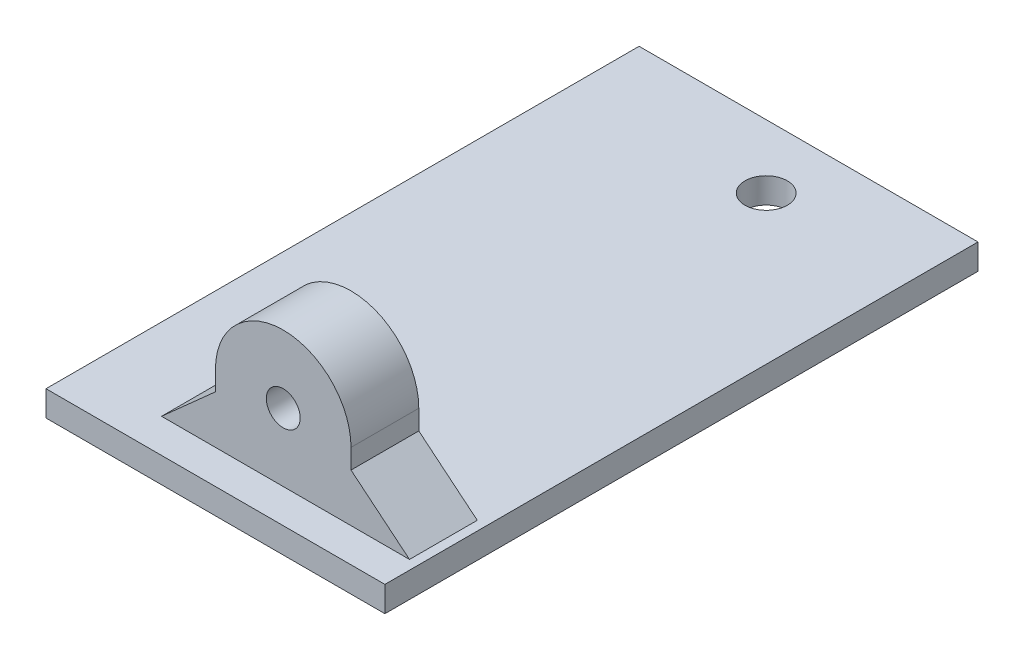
SolidWorks part; units mm, degrees
ref_plane "Front Plane" through (0, 0, 0) normal (0, 0, 1) x (1, 0, 0)
ref_plane "Top Plane" through (0, 0, 0) normal (0, 1, 0) x (1, 0, 0)
ref_plane "Right Plane" through (0, 0, 0) normal (1, 0, 0) x (0, 0, -1)
sketch "Sketch1" plane through (0, 0, 0) normal (0, 1, 0) x (1, 0, 0)
  line L1 (-40, -30) -> (40, -30)
  line L2 (-40, -30) -> (-40, 30)
  line L3 (-40, 30) -> (40, 30)
  line L4 (40, -30) -> (40, 30)
  line L5 (0, 30) -> (0, -30) construction
  line L6 (-40, 0) -> (40, 0) construction
  point P0 (0, 0)
  dimension "D1" = 60
  dimension "D2" = 80
extrude "Boss-Extrude1" add sketch "Sketch1" along normal blind 3
sketch "Sketch3" plane through (0, 3, 0) normal (0, 1, 0) x (1, 0, 0)
  line L1 (-26.5, -22.5) -> (22.5, -22.5)
  line L2 (-26.5, -22.5) -> (-26.5, 22.5)
  line L3 (-26.5, 22.5) -> (22.5, 22.5)
  line L4 (22.5, -22.5) -> (22.5, 22.5)
  line L5 (-2, 22.5) -> (-2, -22.5) construction
  line L6 (-26.5, 0) -> (22.5, 0) construction
  circle A0 centre (-26.5, 22.5) radius 2.5
  circle A1 centre (22.5, 22.5) radius 2.5
  circle A2 centre (22.5, -22.5) radius 2.5
  circle A3 centre (-26.5, -22.5) radius 2.5
  point P9 (-2, 0)
  dimension "D1" = 5
  dimension "D2" = 49
  dimension "D3" = 45
  dimension "D4" = 22.5
extrude "Cut-Extrude1" cut sketch "Sketch3" against normal blind 10 contours L3 A0 L2 | L2 A0 L3 | L4 A1 L3 | L3 A1 L4 | L1 A2 L4 | L4 A2 L1 | L2 A3 L1 | L1 A3 L2
sketch "Sketch9" plane through (0, 3, 0) normal (0, 1, 0) x (1, 0, 0)
  line L1 (-33, 8.2578) -> (-17, 8.2578)
  line L2 (-33, 8.2578) -> (-33, 0.2578)
  line L3 (-33, 0.2578) -> (-17, 0.2578)
  line L4 (-17, 8.2578) -> (-17, 0.2578)
  line L5 (-25, 0.2578) -> (-25, 8.2578) construction
  line L6 (-33, 4.2578) -> (-17, 4.2578) construction
  point P0 (-25, 4.2578)
  dimension "D1" = 8
  dimension "D2" = 16
  dimension "D4" = 25
extrude "Boss-Extrude3" add sketch "Sketch9" along normal blind 50
sketch "Sketch10" plane through (0, 0, -0.2578) normal (0, 0, 1) x (1, 0, 0)
  line L0 (-33, 53) -> (-17, 53) construction
  line L1 (-33, 53) -> (-33, 3) construction
  line L2 (-17, 53) -> (-17, 3) construction
  line L3 (-33, 45) -> (-33, 53)
  line L4 (-33, 53) -> (-17, 53)
  line L5 (-17, 53) -> (-17, 45)
  circle A0 centre (-25, 45) radius 8
extrude "Cut-Extrude3" cut sketch "Sketch10" against normal blind 50
sketch "Sketch11" plane through (0, 3, 0) normal (0, 1, 0) x (1, 0, 0)
  line L0 (24, -36) -> (24, -31.3272) construction
  line L1 (16, -28) -> (32, -28)
  line L2 (16, -28) -> (16, -36)
  line L3 (16, -36) -> (32, -36)
  line L4 (32, -28) -> (32, -36)
  line L5 (24, -36) -> (24, -28) construction
  line L6 (16, -32) -> (32, -32) construction
  point P0 (24, -32)
  dimension "D1" = 8
  dimension "D2" = 16
  dimension "D3" = 32
  dimension "D4" = 16
extrude "Boss-Extrude4" add sketch "Sketch11" along normal blind 16 contours L1 L4 L3 L2
sketch "Sketch12" plane through (0, 0, 36) normal (0, 0, 1) x (1, 0, 0)
  line L0 (16, 19) -> (32, 19) construction
  line L1 (16, 11) -> (14, 19)
  line L2 (14, 19) -> (32, 19)
  line L3 (32, 19) -> (32, 11)
  circle A0 centre (24, 11) radius 8
  circle A1 centre (24, 11) radius 2
  point P6 (24, 19)
  dimension "D1" = 16
  dimension "D2" = 4
extrude "Cut-Extrude4" cut sketch "Sketch12" against normal blind 16 contours A0 M2 M3 | A0 L2 M4 | A1
sketch "Sketch13" plane through (0, 0, 36) normal (0, 0, 1) x (1, 0, 0)
  line L0 (24, 9) -> (24, 30.06) construction
  circle A0 centre (24, 11) radius 2 construction
ref_plane "Plane1" through (24, 0, 0) normal (1, 0, 0) x (0, 0, -1)
split "Split1" trim tools "Right Plane" bodies to split 112 resulting bodies 113 114
move or copy body "Body-Move/Copy1" bodies to move or copy 114 copy no translate (-47.17, 0, 0)
sketch "Sketch14" plane through (0, 0, -0.2578) normal (0, 0, 1) x (1, 0, 0)
  line L0 (-78.4102, 23.6296) -> (-66.1102, 23.6296)
  line L1 (-78.4102, 46.4296) -> (-78.4102, 23.6296)
  line L2 (-66.1102, 46.4296) -> (-78.4102, 46.4296)
  line L3 (-66.1102, 23.6296) -> (-66.1102, 46.4296)
  circle A0 centre (-72.2602, 20.7796) radius 1
  circle A1 centre (-72.2602, 49.2796) radius 1
extrude "Cut-Extrude5" cut sketch "Sketch14" against normal blind 10
sketch "Sketch15" plane through (0, 3, 0) normal (0, 1, 0) x (1, 0, 0)
  line L0 (-54.67, 22.5) -> (-73.67, 22.5) construction
  line L1 (-73.67, -22.5) -> (-54.67, -22.5) construction
  line L2 (-52.17, 22.5) -> (-52.17, 13.6809) construction
  line L3 (-47.17, 30) -> (-47.17, -30) construction
  circle A0 centre (-54.67, 22.5) radius 2.5
  circle A1 centre (-54.67, -22.5) radius 2.5
  circle A2 centre (-73.67, 22.5) radius 2.5 construction
  dimension "D1" = 5
extrude "Cut-Extrude6" cut sketch "Sketch15" against normal blind 10 contours A1 | A0
sketch "Sketch17" plane through (0, 0, 30) normal (0, 0, 1) x (1, 0, 0)
  line L6 (16, 3) -> (0, 3)
  line L7 (0, 3) -> (0, 0)
  line L8 (0, 0) -> (40, 0)
  line L9 (40, 0) -> (40, 3)
  line L10 (40, 3) -> (32, 3)
  line L11 (32, 3) -> (16, 3)
  line L12 (16, 3) -> (0, 3)
  line L13 (0, 3) -> (0, 0)
  line L14 (0, 0) -> (40, 0)
  line L15 (40, 0) -> (40, 3)
  line L16 (40, 3) -> (32, 3)
  line L17 (32, 3) -> (16, 3)
  dimension "D1" = 0
extrude "Boss-Extrude6" add sketch "Sketch17" along normal blind 10
sketch "Sketch18" plane through (0, 0, 36) normal (0, 0, 1) x (1, 0, 0)
  line L0 (16, 8.682) -> (9.6381, 3)
  line L1 (16, 11) -> (16, 3) construction
  line L2 (40, 3) -> (0, 3) construction
  line L3 (9.6381, 3) -> (16, 3)
  line L4 (32, 8.682) -> (38.9012, 3)
  line L5 (32, 11) -> (32, 3) construction
  line L6 (38.9012, 3) -> (32, 3)
  line L7 (32, 3) -> (32, 8.682)
extrude "Boss-Extrude7" add sketch "Sketch18" against normal up to surface (8 mm away) contours L0 L3 M3 | L4 L6 L7
sketch "Sketch19" plane through (0, 3, 0) normal (0, 1, 0) x (1, 0, 0)
  line L0 (-54.67, 22.5) -> (22.5, 22.5) construction
  dimension "D1" = 77.17
sketch "Sketch20" plane through (0, 3, 0) normal (0, 1, 0) x (1, 0, 0)
  line L0 (0, 30) -> (0, -9.2379) construction
  line L1 (0, 30) -> (0, -40) construction
  line L2 (-47.17, 30) -> (-47.17, 5.4464) construction
  line L3 (-47.17, 30) -> (-47.17, -30) construction
sketch "Sketch21" plane through (0, 0, 0) normal (0, 0, 1) x (1, 0, 0)
  line L1 (-109.9881, -8.2212) -> (-28.2252, -8.2212)
  line L2 (-109.9881, -8.2212) -> (-109.9881, 57.8611)
  line L3 (-109.9881, 57.8611) -> (-28.2252, 57.8611)
  line L4 (-28.2252, -8.2212) -> (-28.2252, 57.8611)
extrude "Cut-Extrude7" cut sketch "Sketch21" against normal mid plane 80
